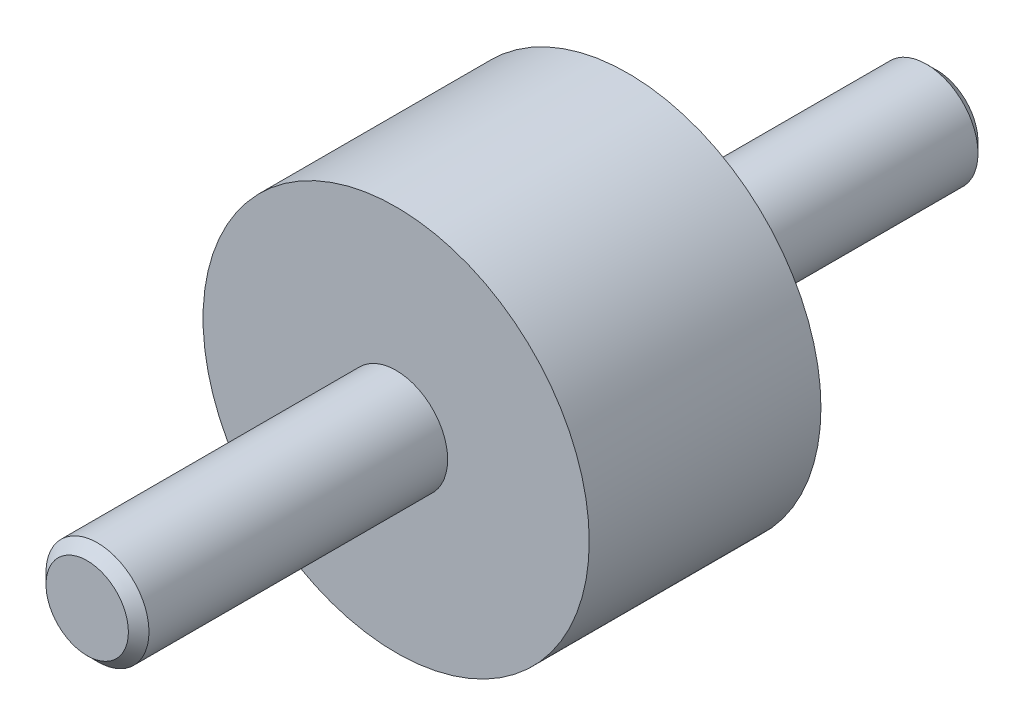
SolidWorks part; units mm, degrees
ref_plane "Plan de face" through (0, 0, 0) normal (0, 0, 1) x (1, 0, 0)
ref_plane "Plan de dessus" through (0, 0, 0) normal (0, 1, 0) x (1, 0, 0)
ref_plane "Plan de droite" through (0, 0, 0) normal (1, 0, 0) x (0, 0, -1)
sketch "Esquisse1" plane through (0, 0, 0) normal (0, 0, 1) x (1, 0, 0)
  circle A0 centre (0, 0) radius 7.5
  dimension "D1" = 15
extrude "Extrusion1" add sketch "Esquisse1" along normal blind 9
sketch "Esquisse2" plane through (0, 0, 9) normal (0, 0, 1) x (1, 0, 0)
  circle A0 centre (0, 0) radius 2
  dimension "D1" = 4
extrude "Extrusion2" add sketch "Esquisse2" along normal blind 12
sketch "Esquisse3" plane through (0, 0, 0) normal (0, 0, -1) x (-1, 0, 0)
  circle A0 centre (0, 0) radius 2
  dimension "D1" = 4
extrude "Extrusion3" add sketch "Esquisse3" along normal blind 12
chamfer "Chanfrein1" distance 0.4 angle 45 2 edges at (-2, 0, -12) (2, 0, 21)
